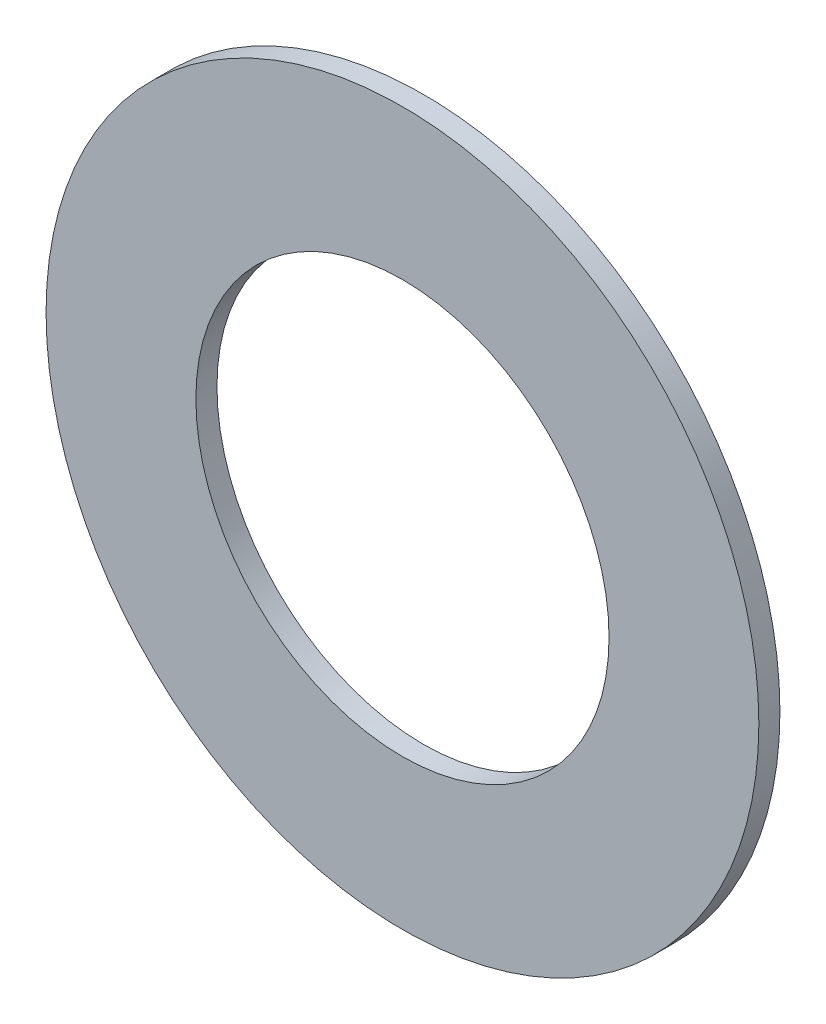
SolidWorks part; units mm, degrees
ref_plane "Front Plane" through (0, 0, 0) normal (1, 0, 0) x (0, 1, 0)
ref_plane "Top Plane" through (0, 0, 0) normal (0, 0, 1) x (0, 1, 0)
ref_plane "Right Plane" through (0, 0, 0) normal (0, 1, 0) x (-1, 0, 0)
sketch "sk 3.5in Nut" plane through (0, 0, 0) normal (0, 0, 1) x (0, 1, 0)
  line B0 (38.7698, -67.1513) -> (77.5396, 0)
  line B1 (77.5396, 0) -> (38.7698, 67.1513)
  line B2 (38.7698, 67.1513) -> (-38.7698, 67.1513)
  line B3 (-38.7698, 67.1513) -> (-77.5396, 0)
  line B4 (-77.5396, 0) -> (-38.7698, -67.1513)
  line B5 (-38.7698, -67.1513) -> (38.7698, -67.1513)
  circle B6 centre (0, 0) radius 44.45
  circle B7 centre (0, 0) radius 67.1512 construction
sketch_block_instance "3.5in nut-1"
sketch_block "3.5in nut"
sketch "sk 3.0in nut"
sketch_block_instance "3.0in nut-1"
sketch_block "3.0in nut" parameters "D1"=76.2, "D2"=115.57
sketch "sk 2.25in nut" plane through (0, 0, 0) normal (0, 0, 1) x (0, 1, 0)
  circle A2 centre (0, 0) radius 50.5052
  line B0 (25.2526, -43.7388) -> (50.5052, 0)
  line B1 (50.5052, 0) -> (25.2526, 43.7388)
  line B2 (25.2526, 43.7388) -> (-25.2526, 43.7388)
  line B3 (-25.2526, 43.7388) -> (-50.5052, 0)
  line B4 (-50.5052, 0) -> (-25.2526, -43.7388)
  line B5 (-25.2526, -43.7388) -> (25.2526, -43.7388)
  circle B6 centre (0, 0) radius 28.575
  circle B7 centre (0, 0) radius 43.7388 construction
sketch_block_instance "2.25in nut-1"
sketch_block "2.25in nut" parameters "D1"=57.15, "D2"=87.4776
sketch "Sketch2" plane through (0, 0, 0) normal (0, 0, 1) x (0, 1, 0)
  circle A2 centre (0, 0) radius 31.115
  circle A6 centre (0, 0) radius 53.6802
  circle A7 centre (0, 0) radius 53.6802
  dimension "D2" = 62.23
  dimension "D1" = 3.175
extrude "Boss-Extrude1" add sketch "Sketch2" along normal mid plane 3.175
